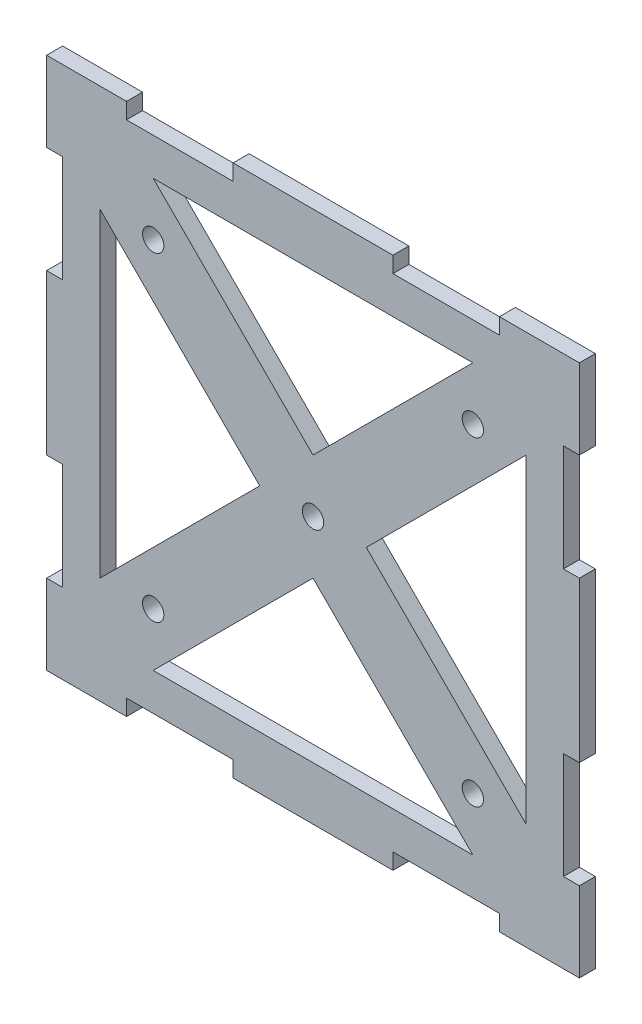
SolidWorks part; units mm, degrees
ref_plane "Plan de face" through (0, 0, 0) normal (0, 0, 1) x (1, 0, 0)
ref_plane "Plan de dessus" through (0, 0, 0) normal (0, 1, 0) x (1, 0, 0)
ref_plane "Plan de droite" through (0, 0, 0) normal (1, 0, 0) x (0, 0, -1)
sketch "Esquisse1" plane through (0, 0, 0) normal (0, 0, 1) x (1, 0, 0)
  line L0 (-36.3514, 95.5523) -> (-36.3514, -4.4477) construction
  line L1 (-86.3514, 103.4275) -> (13.6486, 103.4275)
  line L2 (-86.3514, 103.4275) -> (-86.3514, 3.4275)
  line L3 (-86.3514, 3.4275) -> (13.6486, 3.4275)
  line L4 (13.6486, 103.4275) -> (13.6486, 3.4275)
  line L5 (-76.3514, 93.4275) -> (3.6486, 93.4275)
  line L6 (-76.3514, 93.4275) -> (-76.3514, 13.4275)
  line L7 (-76.3514, 13.4275) -> (3.6486, 13.4275)
  line L8 (3.6486, 93.4275) -> (3.6486, 13.4275)
  line L9 (-94.8547, 53.4275) -> (5.1453, 53.4275) construction
  line L10 (-76.3514, 83.4275) -> (-46.3514, 53.4275)
  line L11 (-66.3514, 93.4275) -> (-36.3514, 63.4275)
  line L12 (-76.3514, 23.4275) -> (-46.3514, 53.4275)
  line L13 (-6.3514, 93.4275) -> (-36.3514, 63.4275)
  line L14 (3.6486, 83.4275) -> (-26.3514, 53.4275)
  line L15 (-66.3514, 13.4275) -> (-36.3514, 43.4275)
  line L16 (-36.3514, 43.4275) -> (-6.3514, 13.4275)
  line L17 (-26.3514, 53.4275) -> (3.6486, 23.4275)
  line L19 (-66.3514, 83.4275) -> (-6.3514, 83.4275) construction
  line L20 (-66.3514, 83.4275) -> (-66.3514, 23.4275) construction
  line L21 (-66.3514, 23.4275) -> (-6.3514, 23.4275) construction
  line L22 (-6.3514, 83.4275) -> (-6.3514, 23.4275) construction
  circle A0 centre (-36.3514, 53.4275) radius 2
  circle A1 centre (-66.3514, 83.4275) radius 2
  circle A2 centre (-6.3514, 83.4275) radius 2
  circle A3 centre (-6.3514, 23.4275) radius 2
  circle A4 centre (-66.3514, 23.4275) radius 2
  point P15 (13.6486, 53.4275)
  point P23 (-36.3514, 3.4275)
  dimension "D25" = 4
  dimension "D26" = 4
  dimension "D27" = 4
  dimension "D28" = 4
  dimension "D29" = 4
  dimension "D1" = 100
  dimension "D2" = 100
  dimension "D3" = 10
  dimension "D4" = 10
  dimension "D5" = 10
  dimension "D6" = 10
  dimension "D7" = 45
  dimension "D8" = 45
  dimension "D9" = 10
  dimension "D10" = 10
  dimension "D11" = 45
  dimension "D12" = 10
  dimension "D13" = 45
  dimension "D14" = 10
  dimension "D15" = 45
  dimension "D16" = 10
  dimension "D17" = 10
  dimension "D18" = 10
  dimension "D19" = 10
  dimension "D20" = 45
  dimension "D21" = 45
  dimension "D22" = 45
  dimension "D23" = 0
  dimension "D24" = 0
extrude "Boss.-Extru.1" add sketch "Esquisse1" along normal blind 3 contours L4 L1 L2 L3 L5 L8 L7 L6 | L17 L14 L8 L5 L13 L11 L6 L10 L12 L7 L15 L16 A4 A3 A2 A1 A0
sketch "Esquisse2" plane through (0, 0, 3) normal (0, 0, 1) x (1, 0, 0)
  line L0 (-86.3514, 53.4275) -> (13.6486, 53.4275) construction
  line L1 (-86.3514, 103.4275) -> (-86.3514, 3.4275) construction
  line L3 (-36.3514, 103.4275) -> (-36.3514, 3.4275) construction
  line L4 (-86.3514, 103.4275) -> (13.6486, 103.4275) construction
  line L6 (-83.3514, 18.4275) -> (-83.3514, 38.4275)
  line L7 (-71.3514, 103.4275) -> (-51.3514, 103.4275)
  line L8 (-71.3514, 103.4275) -> (-71.3514, 100.4275)
  line L9 (-71.3514, 100.4275) -> (-51.3514, 100.4275)
  line L10 (-51.3514, 103.4275) -> (-51.3514, 100.4275)
  line L11 (-86.3514, 88.4275) -> (-83.3514, 88.4275)
  line L12 (-86.3514, 88.4275) -> (-86.3514, 68.4275)
  line L13 (-86.3514, 68.4275) -> (-83.3514, 68.4275)
  line L14 (-83.3514, 88.4275) -> (-83.3514, 68.4275)
  line L15 (-86.3514, 38.4275) -> (-83.3514, 38.4275)
  line L16 (-86.3514, 18.4275) -> (-86.3514, 38.4275)
  line L17 (-86.3514, 18.4275) -> (-83.3514, 18.4275)
  line L18 (-51.3514, 3.4275) -> (-51.3514, 6.4275)
  line L19 (-71.3514, 6.4275) -> (-51.3514, 6.4275)
  line L20 (-71.3514, 3.4275) -> (-71.3514, 6.4275)
  line L21 (-71.3514, 3.4275) -> (-51.3514, 3.4275)
  line L22 (-1.3514, 3.4275) -> (-21.3514, 3.4275)
  line L23 (-1.3514, 3.4275) -> (-1.3514, 6.4275)
  line L24 (-1.3514, 6.4275) -> (-21.3514, 6.4275)
  line L25 (-21.3514, 3.4275) -> (-21.3514, 6.4275)
  line L26 (13.6486, 18.4275) -> (10.6486, 18.4275)
  line L27 (13.6486, 18.4275) -> (13.6486, 38.4275)
  line L28 (13.6486, 38.4275) -> (10.6486, 38.4275)
  line L29 (10.6486, 88.4275) -> (10.6486, 68.4275)
  line L30 (13.6486, 68.4275) -> (10.6486, 68.4275)
  line L31 (13.6486, 88.4275) -> (13.6486, 68.4275)
  line L32 (13.6486, 88.4275) -> (10.6486, 88.4275)
  line L33 (-21.3514, 103.4275) -> (-21.3514, 100.4275)
  line L34 (-1.3514, 100.4275) -> (-21.3514, 100.4275)
  line L35 (-1.3514, 103.4275) -> (-1.3514, 100.4275)
  line L36 (-1.3514, 103.4275) -> (-21.3514, 103.4275)
  line L37 (10.6486, 18.4275) -> (10.6486, 38.4275)
  point P12 (-86.3514, 53.4275)
  point P13 (-36.3514, 103.4275)
  dimension "D1" = 0
  dimension "D2" = 0
  dimension "D3" = 15
  dimension "D4" = 15
  dimension "D5" = 20
  dimension "D6" = 20
  dimension "D7" = 3
  dimension "D8" = 3
extrude "Enlèv. mat.-Extru.1" cut sketch "Esquisse2" against normal up to next
